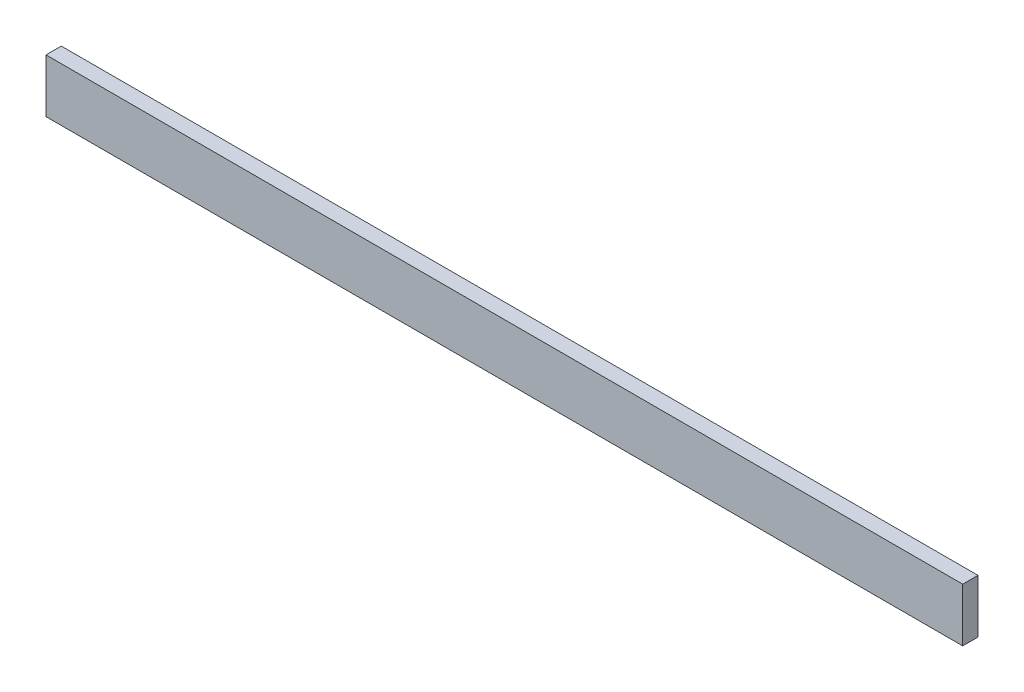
SolidWorks part; units mm, degrees
ref_plane "Спереди" through (0, 0, 0) normal (0, 0, 1) x (1, 0, 0)
ref_plane "Сверху" through (0, 0, 0) normal (0, 1, 0) x (1, 0, 0)
ref_plane "Справа" through (0, 0, 0) normal (1, 0, 0) x (0, 0, -1)
sketch "Эскиз1" plane through (0, 0, 0) normal (0, 0, 1) x (1, 0, 0)
  line L1 (300, 17.5) -> (-300, 17.5)
  line L2 (300, 17.5) -> (300, -17.5)
  line L3 (300, -17.5) -> (-300, -17.5)
  line L4 (-300, 17.5) -> (-300, -17.5)
  line L5 (300, 17.5) -> (-300, -17.5) construction
  line L6 (300, -17.5) -> (-300, 17.5) construction
  point P0 (0, 0)
  dimension "D1" = 600
  dimension "D2" = 35
extrude "Бобышка-Вытянуть1" add sketch "Эскиз1" along normal blind 10
hole_wizard "Отверстие обработанное метчиком M41" positions "Эскиз7" profile "Эскиз8" tap size "M4" standard "ISO"
sketch "Эскиз7" plane through (-300, 0, 0) normal (-1, 0, 0) x (0, 0, 1)
  line L0 (0, 17.5) -> (0, -17.5) construction
  line L1 (10, 17.5) -> (0, 17.5) construction
  point P0 (5, 10)
  point P2 (5, -10)
  dimension "D1" = 5
  dimension "D2" = 7.5
  dimension "D3" = 20
sketch "Эскиз8" plane through (-300, 10, 5) normal (0, 1, 0) x (0, 0, 1)
  line L0 (0, 0) -> (0, 12.4914)
  line L1 (0, 12.4914) -> (1.65, 11.5)
  line L2 (1.65, 11.5) -> (1.65, 8)
  line L3 (1.65, 8) -> (2, 8)
  line L4 (2, 8) -> (2, 0)
  line L5 (2, 0) -> (0, 0)
  line L10 (0, 12.4914) -> (-1.65, 11.5) construction
  line L11 (0, -6.35) -> (0, 107.95) construction
  dimension "Диаметр сверла" = 3.3
  dimension "Глубина сверла" = 11.5
  dimension "Диаметр резьбы" = 4
  dimension "Глубина резьбы" = 8
  dimension "Угол заточки сверла" = 118
hole_wizard "Отверстие обработанное метчиком M42" positions "Эскиз9" profile "Эскиз10" tap size "M4" standard "ISO"
sketch "Эскиз9" plane through (300, 0, 0) normal (1, 0, 0) x (0, 0, -1)
  line L0 (-10, -17.5) -> (-10, 17.5) construction
  line L1 (-10, 17.5) -> (0, 17.5) construction
  point P0 (-5, 10)
  point P2 (-5, -10)
  dimension "D1" = 5
  dimension "D2" = 7.5
  dimension "D3" = 20
sketch "Эскиз10" plane through (300, 10, 5) normal (0, 1, 0) x (0, 0, -1)
  line L0 (0, 0) -> (0, 12.4914)
  line L1 (0, 12.4914) -> (1.65, 11.5)
  line L2 (1.65, 11.5) -> (1.65, 8)
  line L3 (1.65, 8) -> (2, 8)
  line L4 (2, 8) -> (2, 0)
  line L5 (2, 0) -> (0, 0)
  line L10 (0, 12.4914) -> (-1.65, 11.5) construction
  line L11 (0, -6.35) -> (0, 107.95) construction
  dimension "Диаметр сверла" = 3.3
  dimension "Глубина сверла" = 11.5
  dimension "Диаметр резьбы" = 4
  dimension "Глубина резьбы" = 8
  dimension "Угол заточки сверла" = 118
hole_wizard "Отверстие обработанное метчиком M43" positions "Эскиз11" profile "Эскиз12" tap size "M4" standard "ISO"
sketch "Эскиз11" plane through (0, -17.5, 0) normal (0, -1, 0) x (-1, 0, 0)
  line L0 (300, -10) -> (300, 0) construction
  line L2 (300, 0) -> (-300, 0) construction
  point P0 (270, -5)
  dimension "D1" = 30
  dimension "D2" = 5
sketch "Эскиз12" plane through (-270, -17.5, 5) normal (1, 0, 0) x (0, 0, -1)
  line L0 (0, 0) -> (0, 13.4914)
  line L1 (0, 13.4914) -> (1.65, 12.5)
  line L2 (1.65, 12.5) -> (1.65, 0)
  line L5 (1.65, 0) -> (0, 0)
  line L10 (0, 13.4914) -> (-1.65, 12.5) construction
  line L11 (0, -6.35) -> (0, 107.95) construction
  dimension "Диаметр сверла" = 3.3
  dimension "Глубина сверла" = 12.5
  dimension "Угол заточки сверла" = 118
pattern_linear "Линейный массив1" [suppressed] count 7 spacing 90
